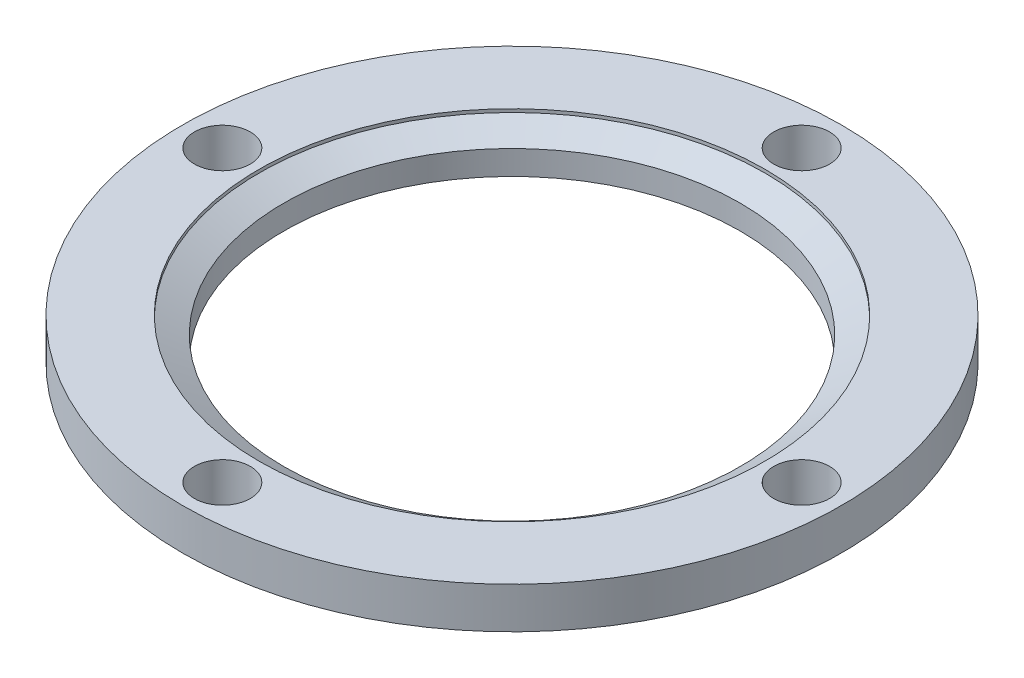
SolidWorks part; units mm, degrees
ref_plane "Front Plane" through (0, 0, 0) normal (0, 0, 1) x (1, 0, 0)
ref_plane "Top Plane" through (0, 0, 0) normal (0, 1, 0) x (1, 0, 0)
ref_plane "Right Plane" through (0, 0, 0) normal (1, 0, 0) x (0, 0, -1)
sketch "Sketch1" plane through (0, 0, 0) normal (0, 0, 1) x (1, 0, 0)
  line L0 (0, 0) -> (0, 3.175) construction
  line L1 (17.5895, 0) -> (25.4, 0)
  line L2 (25.4, 0) -> (25.4, 3.175)
  line L3 (25.4, 3.175) -> (19.4945, 3.175)
  line L4 (19.4945, 3.175) -> (19.4945, 2.921)
  line L6 (17.5895, 0) -> (17.5895, 1.8669)
  line L7 (17.5895, 1.8669) -> (19.4945, 2.921)
  dimension "D1" = 17.5895
  dimension "D2" = 25.4
  dimension "D3" = 3.175
  dimension "D4" = 1.905
  dimension "D5" = 0.254
  dimension "D6" = 1.3081
revolve "Revolve1" add sketch "Sketch1" angle 360 about L0
sketch "Sketch2" plane through (0, 3.175, 0) normal (0, 1, 0) x (-1, 0, 0)
  line L0 (0, 0) -> (-22.3241, 0) construction
  line L1 (0, 0) -> (0, 22.3241) construction
  circle A0 centre (-22.3241, 0) radius 2.1527
  circle A1 centre (0, 22.3241) radius 2.1526
  circle A2 centre (0, -22.3241) radius 2.1526
  circle A3 centre (22.3241, 0) radius 2.1527
extrude "Cut-Extrude1" cut sketch "Sketch2" against normal through all
